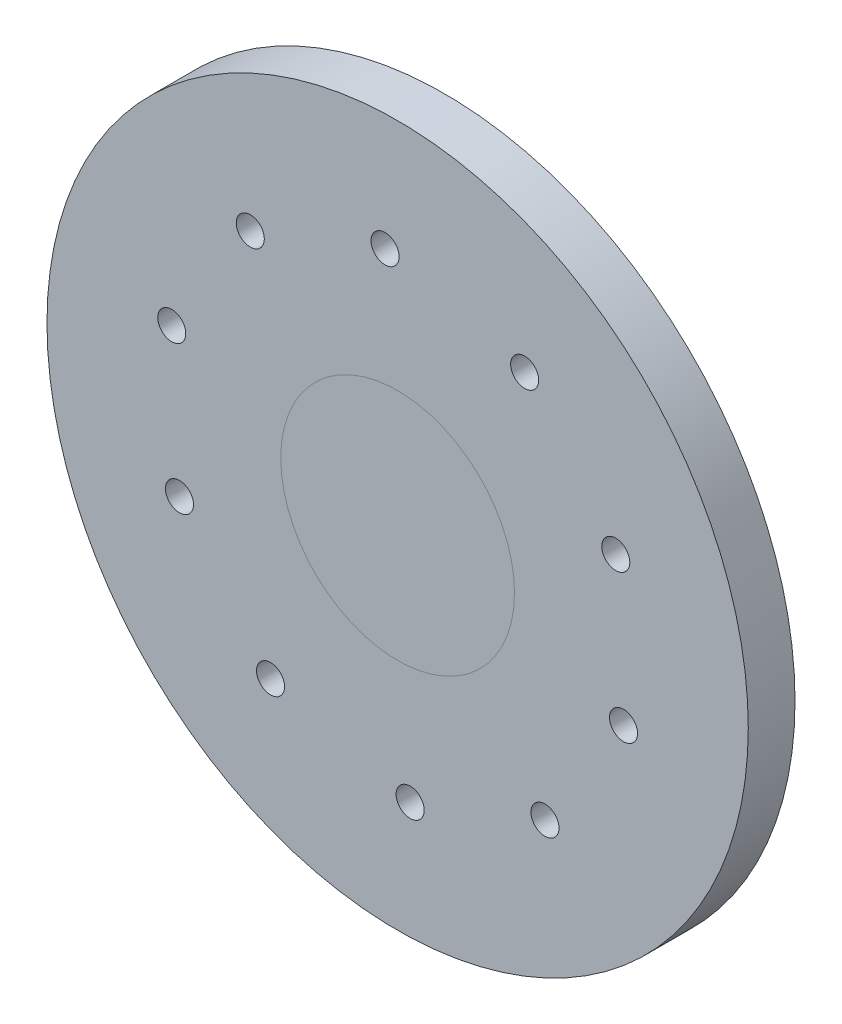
SolidWorks part; units mm, degrees
ref_plane "Front Plane" through (0, 0, 0) normal (0, 0, 1) x (1, 0, 0)
ref_plane "Top Plane" through (0, 0, 0) normal (0, 1, 0) x (1, 0, 0)
ref_plane "Right Plane" through (0, 0, 0) normal (1, 0, 0) x (0, 0, -1)
sketch "Sketch1" plane through (0, 0, 0) normal (0, 0, 1) x (1, 0, 0)
  circle A0 centre (0, 0) radius 150
extrude "Boss-Extrude1" add sketch "Sketch1" along normal blind 20
hole_wizard "Ø12.0 (12) Diameter Hole1" positions "Sketch4" profile "Sketch5" hole size "Ø12.0" standard "ANSI Metric"
sketch "Sketch4" [suppressed] plane through (-59.6282, -279.3511, 0) normal (0, 0, -1) x (1, 0, 0)
  point P0 (0, -201.3694)
  point P2 (44.8573, -189.7144)
  point P4 (98.9507, -185.6591)
  point P6 (141.3755, -212.9301)
  point P8 (166.5169, -251.0522)
  point P10 (162.7368, -318.4186)
  point P12 (128.772, -366.9991)
  point P14 (75.7424, -385.8847)
  point P16 (-17.9667, -336.5459)
  point P18 (-42.2479, -257.9026)
sketch "Sketch5" [suppressed] plane through (-59.6282, -77.9817, 0) normal (1, 0, 0) x (0, 1, 0)
  line L0 (0, 0) -> (0, 20)
  line L1 (0, 20) -> (6, 20)
  line L2 (6, 20) -> (6, 0)
  line L3 (6, 0) -> (0, 0)
  line L4 (0, -6.35) -> (0, 107.95) construction
  dimension "Thru Hole Dia." = 12
  dimension "Thru Hole Depth" = 20
hole_wizard "Ø12.0 (12) Diameter Hole2" positions "Sketch6" profile "Sketch7" hole size "Ø12.0" standard "ANSI Metric"
sketch "Sketch6" plane through (-59.6282, -279.3511, 0) normal (0, 0, -1) x (1, 0, 0)
  point P0 (64.9933, -179.4952)
  point P3 (122.6625, -201.7195)
  point P6 (156.2548, -253.5965)
  point P9 (152.939, -315.3109)
  point P12 (113.9816, -363.2899)
  point P15 (54.2631, -379.2071)
  point P18 (-3.4062, -356.9828)
  point P21 (-36.9984, -305.1058)
  point P24 (-33.6826, -243.3914)
  point P27 (5.2748, -195.4124)
sketch "Sketch7" plane through (5.3651, -99.856, 0) normal (1, 0, 0) x (0, 1, 0)
  line L0 (0, 0) -> (0, 20)
  line L1 (0, 20) -> (6, 20)
  line L2 (6, 20) -> (6, 0)
  line L3 (6, 0) -> (0, 0)
  line L4 (0, -6.35) -> (0, 107.95) construction
  dimension "Thru Hole Dia." = 12
  dimension "Thru Hole Depth" = 20
sketch "Sketch8" plane through (0, 0, 20) normal (0, 0, 1) x (1, 0, 0)
  circle A0 centre (0, 0) radius 50
